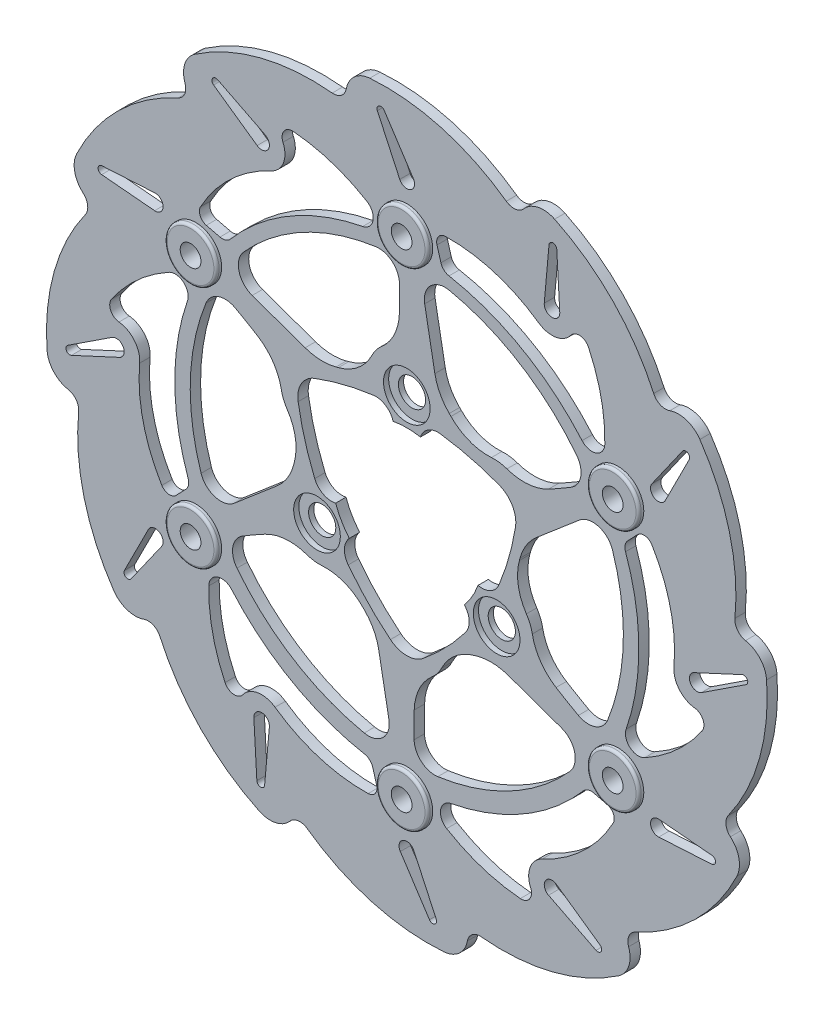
SolidWorks part; units mm, degrees
ref_plane "Plan de face" through (0, 0, 0) normal (0, 0, 1) x (1, 0, 0)
ref_plane "Plan de dessus" through (0, 0, 0) normal (0, 1, 0) x (1, 0, 0)
ref_plane "Plan de droite" through (0, 0, 0) normal (1, 0, 0) x (0, 0, -1)
sketch "Esquisse1" plane through (0, 0, 0) normal (0, 0, 1) x (1, 0, 0)
  circle A0 centre (0, 40) radius 5.25
  circle A1 centre (-34.641, -20) radius 5.25
  circle A2 centre (34.641, -20) radius 5.25
  circle A3 centre (0, 0) radius 29.15
  circle A5 centre (0, 0) radius 139.5
  dimension "D1" = 10.5
  dimension "D2" = 10.5
  dimension "D3" = 10.5
  dimension "D4" = 58.3
  dimension "D5" = 279
extrude "Extrusion1" add sketch "Esquisse1" along normal blind 4
sketch "Esquisse2" plane through (0, 0, 4) normal (0, 0, 1) x (1, 0, 0)
  line L0 (0, 0) -> (0, 146.6848) construction
  circle A0 centre (0, 0) radius 94 construction
  circle A1 centre (0, 94) radius 4
  circle A2 centre (81.4064, 47) radius 4
  circle A3 centre (81.4064, -47) radius 4
  circle A4 centre (0, -94) radius 4
  circle A5 centre (-81.4064, -47) radius 4
  circle A6 centre (-81.4064, 47) radius 4
  dimension "D1" = 188
  dimension "D2" = 8
extrude "Extrusion2" cut sketch "Esquisse2" against normal blind 10
sketch "Esquisse3" plane through (0, 0, 4) normal (0, 0, 1) x (1, 0, 0)
  circle A0 centre (0, 94) radius 10
  circle A1 centre (0, 94) radius 4
  circle A2 centre (81.4064, 47) radius 10
  circle A3 centre (81.4064, 47) radius 4
  circle A4 centre (81.4064, -47) radius 10
  circle A5 centre (81.4064, -47) radius 4
  circle A6 centre (0, -94) radius 10
  circle A7 centre (0, -94) radius 4
  circle A8 centre (-81.4064, -47) radius 10
  circle A9 centre (-81.4064, -47) radius 4
  circle A10 centre (-81.4064, 47) radius 10
  circle A11 centre (-81.4064, 47) radius 4
  dimension "D1" = 20
extrude "Extrusion3" add sketch "Esquisse3" along normal blind 2
fillet "Congé1" radius 1 6 edges at (91.4064, 47, 6) (91.4064, -47, 6) (-71.4064, -47, 6) (-71.4064, 47, 6) (10, 94, 6) (10, -94, 6)
sketch "Esquisse4" plane through (0, 0, 4) normal (0, 0, 1) x (1, 0, 0)
  line L0 (0, 0) -> (0, 139.5) construction
  line L1 (-8.7453, 130.822) -> (2.5094, 113.6441)
  line L2 (-11.3608, 129.369) -> (-2.7216, 110.738)
  line L3 (57.8374, 117.6679) -> (58.9952, 97.164)
  line L4 (54.8457, 117.7172) -> (53.012, 97.2627)
  line L5 (108.9226, 72.9847) -> (99.6734, 54.6489)
  line L6 (106.3564, 74.5233) -> (94.5411, 57.726)
  line L7 (130.822, 8.7453) -> (113.6441, -2.5094)
  line L8 (129.369, 11.3608) -> (110.738, 2.7216)
  line L9 (117.6679, -57.8374) -> (97.164, -58.9952)
  line L10 (117.7172, -54.8457) -> (97.2627, -53.012)
  line L11 (72.9847, -108.9226) -> (54.6489, -99.6734)
  line L12 (74.5233, -106.3564) -> (57.726, -94.5411)
  line L13 (8.7453, -130.822) -> (-2.5094, -113.6441)
  line L14 (11.3608, -129.369) -> (2.7216, -110.738)
  line L15 (-57.8374, -117.6679) -> (-58.9952, -97.164)
  line L16 (-54.8457, -117.7172) -> (-53.012, -97.2627)
  line L17 (-108.9226, -72.9847) -> (-99.6734, -54.6489)
  line L18 (-106.3564, -74.5233) -> (-94.5411, -57.726)
  line L19 (-130.822, -8.7453) -> (-113.6441, 2.5094)
  line L20 (-129.369, -11.3608) -> (-110.738, -2.7216)
  line L21 (-117.6679, 57.8374) -> (-97.164, 58.9952)
  line L22 (-117.7172, 54.8457) -> (-97.2627, 53.012)
  line L23 (-72.9847, 108.9226) -> (-54.6489, 99.6734)
  line L24 (-74.5233, 106.3564) -> (-57.726, 94.5411)
  circle A0 centre (0, 0) radius 139.5 construction
  arc A1 (-2.7216, 110.738) -> (2.5094, 113.6441) centre (0, 112) ccw
  arc A2 (-8.7453, 130.822) -> (-11.3608, 129.369) centre (-10, 130) ccw
  arc A3 (57.8374, 117.6679) -> (54.8457, 117.7172) centre (56.3397, 117.5833) ccw
  arc A4 (53.012, 97.2627) -> (58.9952, 97.164) centre (56, 96.9948) ccw
  arc A5 (108.9226, 72.9847) -> (106.3564, 74.5233) centre (107.5833, 73.6603) ccw
  arc A6 (94.5411, 57.726) -> (99.6734, 54.6489) centre (96.9948, 56) ccw
  arc A7 (130.822, 8.7453) -> (129.369, 11.3608) centre (130, 10) ccw
  arc A8 (110.738, 2.7216) -> (113.6441, -2.5094) centre (112, 0) ccw
  arc A9 (117.6679, -57.8374) -> (117.7172, -54.8457) centre (117.5833, -56.3397) ccw
  arc A10 (97.2627, -53.012) -> (97.164, -58.9952) centre (96.9948, -56) ccw
  arc A11 (72.9847, -108.9226) -> (74.5233, -106.3564) centre (73.6603, -107.5833) ccw
  arc A12 (57.726, -94.5411) -> (54.6489, -99.6734) centre (56, -96.9948) ccw
  arc A13 (8.7453, -130.822) -> (11.3608, -129.369) centre (10, -130) ccw
  arc A14 (2.7216, -110.738) -> (-2.5094, -113.6441) centre (0, -112) ccw
  arc A15 (-57.8374, -117.6679) -> (-54.8457, -117.7172) centre (-56.3397, -117.5833) ccw
  arc A16 (-53.012, -97.2627) -> (-58.9952, -97.164) centre (-56, -96.9948) ccw
  arc A17 (-108.9226, -72.9847) -> (-106.3564, -74.5233) centre (-107.5833, -73.6603) ccw
  arc A18 (-94.5411, -57.726) -> (-99.6734, -54.6489) centre (-96.9948, -56) ccw
  arc A19 (-130.822, -8.7453) -> (-129.369, -11.3608) centre (-130, -10) ccw
  arc A20 (-110.738, -2.7216) -> (-113.6441, 2.5094) centre (-112, 0) ccw
  arc A21 (-117.6679, 57.8374) -> (-117.7172, 54.8457) centre (-117.5833, 56.3397) ccw
  arc A22 (-97.2627, 53.012) -> (-97.164, 58.9952) centre (-96.9948, 56) ccw
  arc A23 (-72.9847, 108.9226) -> (-74.5233, 106.3564) centre (-73.6603, 107.5833) ccw
  arc A24 (-57.726, 94.5411) -> (-54.6489, 99.6734) centre (-56, 96.9948) ccw
  dimension "D1" = 6
  dimension "D3" = 3
  dimension "D4" = 10
  dimension "D5" = 18
  dimension "D2" = 112
extrude "Extrusion4" cut sketch "Esquisse4" against normal blind 10
sketch "Esquisse5" plane through (0, 0, 4) normal (0, 0, 1) x (1, 0, 0)
  line L0 (0, 0) -> (32.0429, 18.5) construction
  line L1 (0, 0) -> (0, 45.25) construction
  line L2 (0, 0) -> (-34.641, -20) construction
  line L3 (0, 0) -> (34.641, -20) construction
  circle A0 centre (0, 40) radius 5.25 construction
  arc A1 (41.9159, 16.911) -> (35.6033, 27.8447) centre (32.0429, 18.5) ccw
  circle A2 centre (0, 0) radius 47 construction
  arc A3 (-6.3126, -44.7557) -> (6.3126, -44.7557) centre (0, -37) ccw
  arc A4 (-35.6033, 27.8447) -> (-41.9159, 16.911) centre (-32.0429, 18.5) ccw
  arc A5 (5.2673, 28.6702) -> (-5.2673, 28.6702) centre (0, 0) ccw
  arc A6 (35.6033, 27.8447) -> (12.9107, 33.5604) centre (0, -65.6026) ccw
  arc A7 (-41.9159, 16.911) -> (-35.5196, -5.5992) centre (56.8135, 32.8013) ccw
  arc A11 (6.3126, -44.7557) -> (22.6088, -27.9612) centre (-56.8135, 32.8013) ccw
  arc A12 (-5.2673, 28.6702) -> (-12.9107, 33.5604) centre (-12, 26.5654) ccw
  arc A13 (12.9107, 33.5604) -> (5.2673, 28.6702) centre (12, 26.5654) ccw
  arc A14 (-35.5196, -5.5992) -> (-27.4627, -9.7735) centre (-29.0063, -2.8904) ccw
  arc A15 (-22.1955, -18.8967) -> (-22.6088, -27.9612) centre (-17.0063, -23.675) ccw
  arc A16 (22.6088, -27.9612) -> (22.1955, -18.8967) centre (17.0063, -23.675) ccw
  arc A17 (27.4627, -9.7735) -> (35.5196, -5.5992) centre (29.0063, -2.8904) ccw
  arc A18 (-12.9107, 33.5604) -> (-35.6033, 27.8447) centre (0, -65.6026) ccw
  arc A19 (-27.4627, -9.7735) -> (-22.1955, -18.8967) centre (0, 0) ccw
  arc A20 (-22.6088, -27.9612) -> (-6.3126, -44.7557) centre (56.8135, 32.8013) ccw
  arc A21 (22.1955, -18.8967) -> (27.4627, -9.7735) centre (0, 0) ccw
  arc A22 (35.5196, -5.5992) -> (41.9159, 16.911) centre (-56.8135, 32.8013) ccw
  dimension "D2" = 20
  dimension "D4" = 94
  dimension "D5" = 64.0859
  dimension "D6" = 58.3
  dimension "D7" = 200
  dimension "D8" = 200
  dimension "D9" = 100
  dimension "D11" = 12
  dimension "D13" = 12
  dimension "D14" = 12
  dimension "D16" = 7.054
  dimension "D1" = 60
  dimension "D3" = 37
  dimension "D10" = 12
  dimension "D12" = 12
  dimension "D15" = 12
extrude "Extrusion5" cut sketch "Esquisse5" against normal blind 10
sketch "Esquisse6" plane through (0, 0, 4) normal (0, 0, 1) x (1, 0, 0)
  circle A0 centre (0, 40) radius 9
  circle A1 centre (34.641, -20) radius 9
  circle A2 centre (-34.641, -20) radius 9
  dimension "D1" = 18
  dimension "D2" = 3
extrude "Extrusion6" cut sketch "Esquisse6" against normal blind 2
sketch "Esquisse8" plane through (0, 0, 4) normal (0, 0, 1) x (1, 0, 0)
  line L0 (11.6407, 96.0177) -> (13.1608, 90.819)
  line L1 (88.9741, 37.9278) -> (85.2319, 34.0119)
  line L2 (77.3335, -58.09) -> (72.0712, -56.807)
  line L3 (-11.6407, -96.0177) -> (-13.1608, -90.819)
  line L4 (-88.9741, -37.9278) -> (-85.2319, -34.0119)
  line L5 (-77.3335, 58.09) -> (-72.0712, 56.807)
  arc A0 (50.8298, 89.6281) -> (63.2607, 91.6767) centre (56, 96.9948) ccw
  arc A1 (70.1012, 91.0285) -> (63.2607, 91.6767) centre (66.4877, 89.3131) ccw
  arc A2 (67.5927, 58.6641) -> (76.3678, 61.8403) centre (71.3688, 61.9415) ccw
  circle A3 centre (81.4064, 47) radius 4 construction
  arc A4 (103.0351, 0.7941) -> (94.4925, 37.3322) centre (43.2691, 6.0885) ccw
  arc A5 (14.9156, 100.499) -> (11.6407, 96.0177) centre (15, 97) ccw
  circle A6 centre (0, 94) radius 4 construction
  arc A7 (13.1608, 90.819) -> (16.2727, 88.0082) centre (17, 91.9416) ccw
  arc A8 (50.8298, 89.6281) -> (14.9156, 100.499) centre (16.3618, 40.5164) ccw
  arc A9 (91.7392, -35.2163) -> (113.8836, -15.1952) centre (60.3842, 21.7211) ccw
  arc A10 (67.5927, 58.6641) -> (16.2727, 88.0082) centre (0, 0) ccw
  arc A11 (113.8836, -15.1952) -> (111.0247, -8.947) centre (110.5913, -12.9235) ccw
  arc A12 (76.3678, 61.8403) -> (70.1012, 91.0285) centre (11.3811, 63.1548) ccw
  arc A13 (103.0351, 0.7941) -> (111.0247, -8.947) centre (112, 0) ccw
  arc A14 (84.601, -29.2049) -> (91.7392, -35.2163) centre (89.3273, -30.8365) ccw
  arc A15 (84.601, -29.2049) -> (84.3537, 29.9115) centre (0, 0) ccw
  arc A16 (85.2319, 34.0119) -> (84.3537, 29.9115) centre (88.1237, 31.2483) ccw
  arc A17 (94.4925, 37.3322) -> (88.9741, 37.9278) centre (91.5045, 35.5096) ccw
  arc A18 (52.2053, -88.8339) -> (79.5769, -63.1668) centre (26.9073, -34.4279) ccw
  arc A19 (15.3714, -97.0566) -> (43.7823, -106.2237) centre (49.0031, -41.4337) ccw
  arc A20 (43.7823, -106.2237) -> (47.764, -100.6238) centre (44.1036, -102.2366) ccw
  arc A21 (52.2053, -88.8339) -> (47.764, -100.6238) centre (56, -96.9948) ccw
  arc A22 (17.0083, -87.869) -> (15.3714, -97.0566) centre (17.9585, -92.7779) ccw
  arc A23 (17.0083, -87.869) -> (68.081, -58.0967) centre (0, 0) ccw
  arc A24 (72.0712, -56.807) -> (68.081, -58.0967) centre (71.1237, -60.6932) ccw
  arc A25 (79.5769, -63.1668) -> (77.3335, -58.09) centre (76.5045, -61.4904) ccw
  arc A26 (-50.8298, -89.6281) -> (-14.9156, -100.499) centre (-16.3618, -40.5164) ccw
  arc A27 (-76.3678, -61.8403) -> (-70.1012, -91.0285) centre (-11.3811, -63.1548) ccw
  arc A28 (-70.1012, -91.0285) -> (-63.2607, -91.6767) centre (-66.4877, -89.3131) ccw
  arc A29 (-50.8298, -89.6281) -> (-63.2607, -91.6767) centre (-56, -96.9948) ccw
  arc A30 (-67.5927, -58.6641) -> (-76.3678, -61.8403) centre (-71.3688, -61.9415) ccw
  arc A31 (-67.5927, -58.6641) -> (-16.2727, -88.0082) centre (0, 0) ccw
  arc A32 (-13.1608, -90.819) -> (-16.2727, -88.0082) centre (-17, -91.9416) ccw
  arc A33 (-14.9156, -100.499) -> (-11.6407, -96.0177) centre (-15, -97) ccw
  arc A34 (-103.0351, -0.7941) -> (-94.4925, -37.3322) centre (-43.2691, -6.0885) ccw
  arc A35 (-91.7392, 35.2163) -> (-113.8836, 15.1952) centre (-60.3842, -21.7211) ccw
  arc A36 (-113.8836, 15.1952) -> (-111.0247, 8.947) centre (-110.5913, 12.9235) ccw
  arc A37 (-103.0351, -0.7941) -> (-111.0247, 8.947) centre (-112, 0) ccw
  arc A38 (-84.601, 29.2049) -> (-91.7392, 35.2163) centre (-89.3273, 30.8365) ccw
  arc A39 (-84.601, 29.2049) -> (-84.3537, -29.9115) centre (0, 0) ccw
  arc A40 (-85.2319, -34.0119) -> (-84.3537, -29.9115) centre (-88.1237, -31.2483) ccw
  arc A41 (-94.4925, -37.3322) -> (-88.9741, -37.9278) centre (-91.5045, -35.5096) ccw
  arc A42 (-52.2053, 88.8339) -> (-79.5769, 63.1668) centre (-26.9073, 34.4279) ccw
  arc A43 (-15.3714, 97.0566) -> (-43.7823, 106.2237) centre (-49.0031, 41.4337) ccw
  arc A44 (-43.7823, 106.2237) -> (-47.764, 100.6238) centre (-44.1036, 102.2366) ccw
  arc A45 (-52.2053, 88.8339) -> (-47.764, 100.6238) centre (-56, 96.9948) ccw
  arc A46 (-17.0083, 87.869) -> (-15.3714, 97.0566) centre (-17.9585, 92.7779) ccw
  arc A47 (-17.0083, 87.869) -> (-68.081, 58.0967) centre (0, 0) ccw
  arc A48 (-72.0712, 56.807) -> (-68.081, 58.0967) centre (-71.1237, 60.6932) ccw
  arc A49 (-79.5769, 63.1668) -> (-77.3335, 58.09) centre (-76.5045, 61.4904) ccw
  dimension "D1" = 18
  dimension "D2" = 18
  dimension "D3" = 10
  dimension "D4" = 18
  dimension "D5" = 10.0376
  dimension "D6" = 15
  dimension "D7" = 3
  dimension "D8" = 7
  dimension "D9" = 8
  dimension "D10" = 17
  dimension "D11" = 120
  dimension "D12" = 89.5
  dimension "D13" = 65
  dimension "D14" = 4
extrude "Extrusion7" cut sketch "Esquisse8" against normal blind 10
sketch "Esquisse9" plane through (0, 0, 4) normal (0, 0, 1) x (1, 0, 0)
  arc A0 (-81.7539, 113.0284) -> (-85.5458, 101.4357) centre (-76.1175, 104.7682) ccw
  circle A1 centre (0, 0) radius 139.5 construction
  circle A2 centre (-28.1552, 131.5201) radius 5 construction
  arc A3 (-28.7757, 126.5572) -> (-81.7539, 113.0284) centre (-36.6625, 46.9469) ccw
  arc A4 (-88.1991, 95.2139) -> (-85.5458, 101.4357) centre (-90.26, 99.7694) ccw
  arc A5 (-2.7216, 110.738) -> (2.5094, 113.6441) centre (0, 112) ccw construction
  circle A6 centre (0, 0) radius 139.5 construction
  circle A7 centre (0, 0) radius 139.5 construction
  arc A8 (-57.726, 94.5411) -> (-54.6489, 99.6734) centre (-56, 96.9948) ccw construction
  arc A9 (38.3581, 123.9896) -> (-14.2867, 138.7624) centre (-8.2772, 58.9885) ccw
  arc A10 (-14.2867, 138.7624) -> (-23.367, 130.6188) centre (-13.5355, 128.7907) ccw
  arc A11 (-28.7757, 126.5572) -> (-23.367, 130.6188) centre (-28.2828, 131.5328) ccw
  arc A12 (95.2139, 88.1991) -> (57.0086, 127.3151) centre (22.326, 55.2241) ccw
  arc A13 (57.0086, 127.3151) -> (45.073, 124.8027) centre (52.6732, 118.3038) ccw
  arc A14 (38.3581, 123.9896) -> (45.073, 124.8027) centre (41.2728, 128.0522) ccw
  arc A15 (126.5572, 28.7757) -> (113.0284, 81.7539) centre (46.9469, 36.6625) ccw
  arc A16 (113.0284, 81.7539) -> (101.4357, 85.5458) centre (104.7682, 76.1175) ccw
  arc A17 (95.2139, 88.1991) -> (101.4357, 85.5458) centre (99.7694, 90.26) ccw
  arc A18 (123.9896, -38.3581) -> (138.7624, 14.2867) centre (58.9885, 8.2772) ccw
  arc A19 (138.7624, 14.2867) -> (130.6188, 23.367) centre (128.7907, 13.5355) ccw
  arc A20 (126.5572, 28.7757) -> (130.6188, 23.367) centre (131.5328, 28.2828) ccw
  arc A21 (88.1991, -95.2139) -> (127.3151, -57.0086) centre (55.2241, -22.326) ccw
  arc A22 (127.3151, -57.0086) -> (124.8027, -45.073) centre (118.3038, -52.6732) ccw
  arc A23 (123.9896, -38.3581) -> (124.8027, -45.073) centre (128.0522, -41.2728) ccw
  arc A24 (28.7757, -126.5572) -> (81.7539, -113.0284) centre (36.6625, -46.9469) ccw
  arc A25 (81.7539, -113.0284) -> (85.5458, -101.4357) centre (76.1175, -104.7682) ccw
  arc A26 (88.1991, -95.2139) -> (85.5458, -101.4357) centre (90.26, -99.7694) ccw
  arc A27 (-38.3581, -123.9896) -> (14.2867, -138.7624) centre (8.2772, -58.9885) ccw
  arc A28 (14.2867, -138.7624) -> (23.367, -130.6188) centre (13.5355, -128.7907) ccw
  arc A29 (28.7757, -126.5572) -> (23.367, -130.6188) centre (28.2828, -131.5328) ccw
  arc A30 (-95.2139, -88.1991) -> (-57.0086, -127.3151) centre (-22.326, -55.2241) ccw
  arc A31 (-57.0086, -127.3151) -> (-45.073, -124.8027) centre (-52.6732, -118.3038) ccw
  arc A32 (-38.3581, -123.9896) -> (-45.073, -124.8027) centre (-41.2728, -128.0522) ccw
  arc A33 (-126.5572, -28.7757) -> (-113.0284, -81.7539) centre (-46.9469, -36.6625) ccw
  arc A34 (-113.0284, -81.7539) -> (-101.4357, -85.5458) centre (-104.7682, -76.1175) ccw
  arc A35 (-95.2139, -88.1991) -> (-101.4357, -85.5458) centre (-99.7694, -90.26) ccw
  arc A36 (-123.9896, 38.3581) -> (-138.7624, -14.2867) centre (-58.9885, -8.2772) ccw
  arc A37 (-138.7624, -14.2867) -> (-130.6188, -23.367) centre (-128.7907, -13.5355) ccw
  arc A38 (-126.5572, -28.7757) -> (-130.6188, -23.367) centre (-131.5328, -28.2828) ccw
  arc A39 (-88.1991, 95.2139) -> (-127.3151, 57.0086) centre (-55.2241, 22.326) ccw
  arc A40 (-127.3151, 57.0086) -> (-124.8027, 45.073) centre (-118.3038, 52.6732) ccw
  arc A41 (-123.9896, 38.3581) -> (-124.8027, 45.073) centre (-128.0522, 41.2728) ccw
  dimension "D1" = 10
  dimension "D2" = 34.26
  dimension "D3" = 10
  dimension "D4" = 10
  dimension "D5" = 34.26
  dimension "D6" = 160
extrude "Extrusion8" cut sketch "Esquisse9" against normal blind 10 flip side to cut
sketch "Esquisse10" plane through (0, 0, 4) normal (0, 0, 1) x (1, 0, 0)
  line L0 (-59.6522, 43.5138) -> (-39.2116, 36.2494)
  line L1 (6.8919, 73.967) -> (10.821, 52.6327)
  line L2 (66.5372, 31.5646) -> (50.0257, 17.4947)
  line L3 (59.6383, -41.2909) -> (39.1977, -34.0265)
  line L4 (-6.9058, -71.744) -> (-10.835, -50.4097)
  line L5 (-66.5511, -29.3417) -> (-50.0396, -15.2718)
  arc A65 (-13.5563, 38.5186) -> (-37.3834, 32.5171) centre (0, -65.6026) ccw
  arc A66 (-26.4098, 36.0218) -> (-27.3119, 35.7831) centre (0, -65.6026) ccw
  arc A68 (-59.6522, 43.5138) -> (-62.9312, 56.3907) centre (-56.9732, 51.0519) cw
  arc A69 (-26.4098, 36.0218) -> (-13.4744, 46.5909) centre (-31.4403, 55.3788) ccw
  arc A71 (-39.2116, 36.2494) -> (-27.3119, 35.7831) centre (-32.5141, 55.0947) ccw
  arc A72 (-2.866, 65.9241) -> (-9.7961, 51.3594) centre (-22.8576, 66.5053) cw
  arc A74 (-11.9549, 83.65) -> (-2.8248, 75.8969) centre (-10.8231, 75.7305) cw
  arc A75 (54.6929, 35.9938) -> (63.3502, 40.9445) centre (-40.231, 212.032) ccw
  arc A77 (65.4996, 52.728) -> (63.3502, 40.9445) centre (59.207, 47.788) cw
  arc A78 (65.4996, 52.728) -> (16.4041, 83.2451) centre (-0.966, 0.5497) ccw
  arc A79 (-2.866, 65.9241) -> (-2.8248, 75.8969) centre (-202.7815, 71.7367) ccw
  arc A80 (38.6145, 34.7131) -> (32.6457, 35.5144) centre (33.675, 20.5497) ccw
  arc A81 (54.6929, 35.9938) -> (38.6145, 34.7131) centre (45.2005, 53.5976) cw
  circle A82 centre (0, 94) radius 4 construction
  circle A83 centre (0, 40) radius 5.25 construction
  circle A85 centre (-81.4064, 47) radius 4 construction
  arc A86 (-16.0581, 82.9602) -> (-64.2776, 54.8511) centre (0, 0) ccw
  arc A87 (-11.9549, 83.65) -> (-62.9312, 56.3907) centre (0, 0) ccw
  arc A88 (-9.7961, 51.3594) -> (-13.4744, 46.5909) centre (0, 40) ccw
  arc A89 (17.0248, 41.4322) -> (16.3671, 42.094) centre (-57.7796, -32.2516) ccw
  arc A90 (10.821, 52.6327) -> (16.3671, 42.094) centre (30.4903, 56.2551) ccw
  arc A91 (6.8919, 73.967) -> (16.4041, 83.2451) centre (14.7596, 75.4159) cw
  arc A92 (17.0248, 41.4322) -> (32.6457, 35.5144) centre (31.2733, 55.4672) ccw
  arc A93 (57.5519, -28.8188) -> (66.1681, -33.8409) centre (162.5436, 141.4068) ccw
  arc A94 (77.4475, -29.8106) -> (66.1681, -33.8409) centre (70.0231, -26.831) cw
  arc A95 (77.4475, -29.8106) -> (79.3284, 27.9659) centre (-0.973, 1.6612) ccw
  arc A96 (48.4036, -15.5349) -> (46.1131, -9.9651) centre (33.668, -18.3388) ccw
  arc A97 (57.5519, -28.8188) -> (48.4036, -15.5349) centre (68.0511, -11.7963) cw
  arc A98 (43.4277, 6.5219) -> (43.672, 7.4224) centre (-57.7865, 34.4625) ccw
  arc A99 (50.0257, 17.4947) -> (43.672, 7.4224) centre (62.9974, 2.2719) ccw
  arc A100 (66.5372, 31.5646) -> (79.3284, 27.9659) centre (71.7259, 25.4755) cw
  arc A101 (43.4277, 6.5219) -> (46.1131, -9.9651) centre (62.7066, 1.1999) ccw
  arc A102 (2.8521, -63.7011) -> (2.8109, -73.674) centre (202.7676, -69.5138) ccw
  arc A103 (11.941, -81.4271) -> (2.8109, -73.674) centre (10.8092, -73.5076) cw
  arc A104 (11.941, -81.4271) -> (62.9173, -54.1678) centre (-0.0139, 2.2229) ccw
  arc A105 (9.7822, -49.1365) -> (13.4605, -44.368) centre (-0.0139, -37.7771) ccw
  arc A106 (2.8521, -63.7011) -> (9.7822, -49.1365) centre (22.8436, -64.2824) cw
  arc A107 (26.3959, -33.7989) -> (27.298, -33.5602) centre (-0.0139, 67.8256) ccw
  arc A108 (39.1977, -34.0265) -> (27.298, -33.5602) centre (32.5002, -52.8717) ccw
  arc A109 (59.6383, -41.2909) -> (62.9173, -54.1678) centre (56.9593, -48.829) cw
  arc A110 (26.3959, -33.7989) -> (13.4605, -44.368) centre (31.4264, -53.1559) ccw
  arc A111 (-54.7068, -33.7708) -> (-63.3641, -38.7216) centre (40.2171, -209.8091) ccw
  arc A112 (-65.5135, -50.505) -> (-63.3641, -38.7216) centre (-59.2209, -45.5651) cw
  arc A113 (-65.5135, -50.505) -> (-16.418, -81.0222) centre (0.9521, 1.6732) ccw
  arc A114 (-38.6284, -32.4902) -> (-32.6596, -33.2914) centre (-33.6889, -18.3268) ccw
  arc A115 (-54.7068, -33.7708) -> (-38.6284, -32.4902) centre (-45.2144, -51.3747) cw
  arc A116 (-17.0387, -39.2093) -> (-16.381, -39.8711) centre (57.7657, 34.4745) ccw
  arc A117 (-10.835, -50.4097) -> (-16.381, -39.8711) centre (-30.5042, -54.0322) ccw
  arc A118 (-6.9058, -71.744) -> (-16.418, -81.0222) centre (-14.7735, -73.193) cw
  arc A119 (-17.0387, -39.2093) -> (-32.6596, -33.2914) centre (-31.2872, -53.2443) ccw
  arc A120 (-57.5658, 31.0418) -> (-66.182, 36.0639) centre (-162.5575, -139.1838) ccw
  arc A121 (-77.4614, 32.0335) -> (-66.182, 36.0639) centre (-70.037, 29.054) cw
  arc A122 (-77.4614, 32.0335) -> (-79.3423, -25.7429) centre (0.9591, 0.5618) ccw
  arc A123 (-48.4175, 17.7578) -> (-46.127, 12.188) centre (-33.6819, 20.5618) ccw
  arc A124 (-57.5658, 31.0418) -> (-48.4175, 17.7578) centre (-68.065, 14.0192) cw
  arc A125 (-43.4416, -4.2989) -> (-43.6859, -5.1995) centre (57.7726, -32.2396) ccw
  arc A126 (-50.0396, -15.2718) -> (-43.6859, -5.1995) centre (-63.0114, -0.049) ccw
  arc A127 (-66.5511, -29.3417) -> (-79.3423, -25.7429) centre (-71.7398, -23.2525) cw
  arc A128 (-43.4416, -4.2989) -> (-46.127, 12.188) centre (-62.7205, 1.0231) ccw
  dimension "D7" = 400
  dimension "D2" = 15
  dimension "D3" = 8
  dimension "D4" = 20
  dimension "D5" = 8
  dimension "D1" = 5
  dimension "D8" = 5
extrude "Extrusion9" cut sketch "Esquisse10" against normal blind 10
